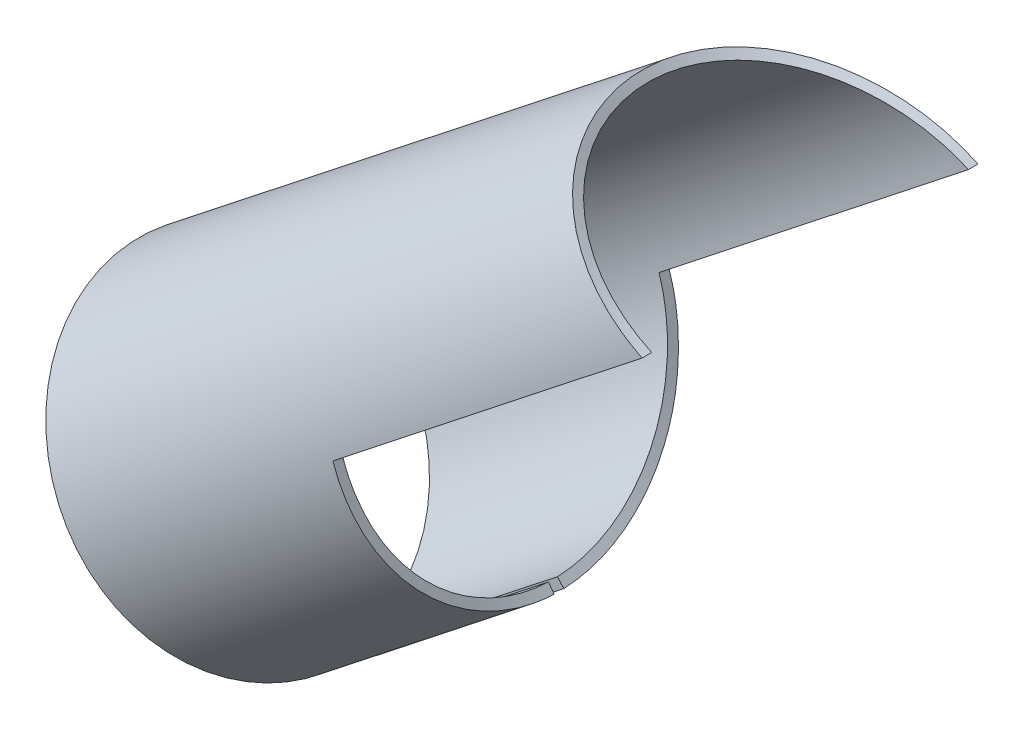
SolidWorks part; units mm, degrees
ref_plane "前视基准面" through (0, 0, 0) normal (0, 0, 1) x (1, 0, 0)
ref_plane "上视基准面" through (0, 0, 0) normal (0, 1, 0) x (1, 0, 0)
ref_plane "右视基准面" through (0, 0, 0) normal (1, 0, 0) x (0, 0, -1)
imported_body "基体零件-带补料的任意角Y形三通管-1"
sheet metal parameters "钣金1" parameters "D1"=0.7366, "厚度"=1
bend "圆角折弯1" bend radius 16.4845 bend angle 356.723 parameters "D5"=1
flatten bends "展开-折弯1" parameters "D1"=0
sketch "尖角-草图1" plane through (-37.1617, -51.5443, -0.5) normal (0.6188, -0.785, -0.0286) x (0.7856, 0.6184, 0.0225)
  line L0 (12.8733, -51.6192) -> (-15.186, -50.9867) construction
process bends "加工-折弯1" parameters "D1"=0
sketch "平面-草图1" plane through (-37.1617, -51.5443, -0.5) normal (0.6188, -0.785, -0.0286) x (0.7856, 0.6184, 0.0225)
